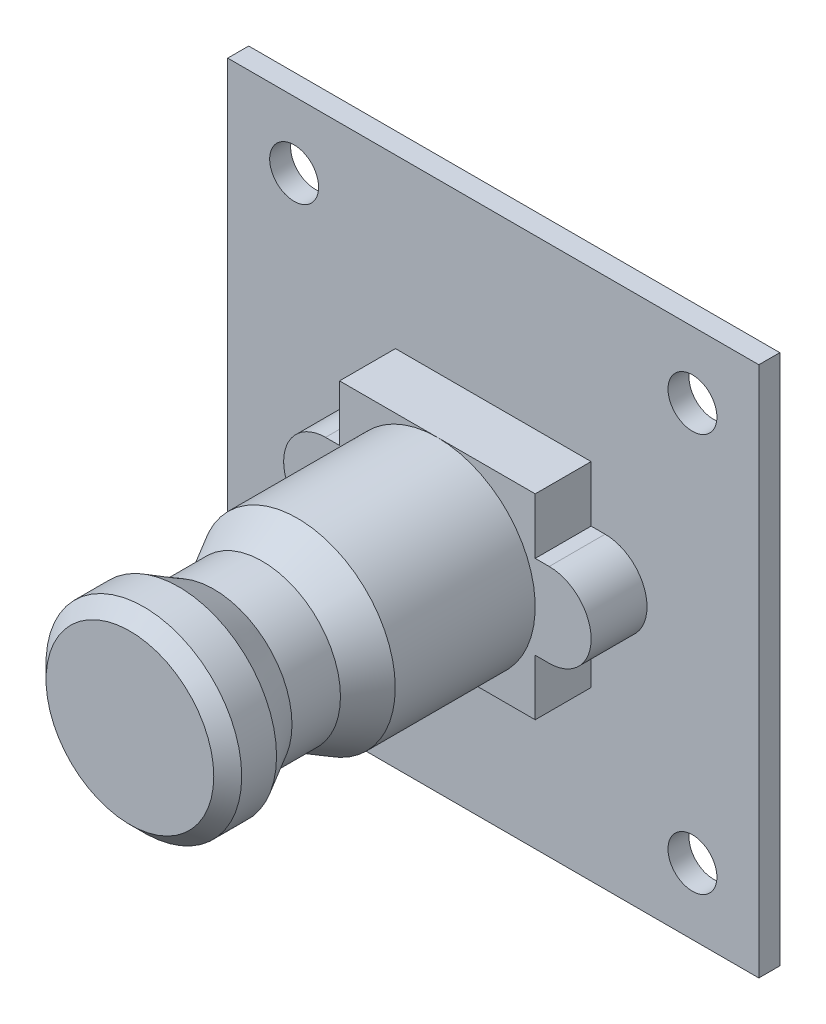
SolidWorks part; units mm, degrees
ref_plane "前视" through (0, 0, 0) normal (0, 0, 1) x (1, 0, 0)
ref_plane "上视" through (0, 0, 0) normal (0, 1, 0) x (1, 0, 0)
ref_plane "右视" through (0, 0, 0) normal (1, 0, 0) x (0, 0, -1)
sketch "草图1" plane through (0, 0, 0) normal (0, 0, 1) x (1, 0, 0)
  line L1 (-19, 19) -> (19, 19)
  line L2 (-19, 19) -> (-19, -19)
  line L3 (-19, -19) -> (19, -19)
  line L4 (19, 19) -> (19, -19)
  line L5 (-19, 19) -> (19, -19) construction
  line L6 (-19, -19) -> (19, 19) construction
  point P0 (0, 0)
  dimension "D1" = 38
  dimension "D2" = 38
extrude "凸台-拉伸1" add sketch "草图1" along normal blind 1.5
hole_wizard "Ø3.5 (3.5) 直径孔1" positions "草图3" profile "草图2" hole size "Ø3.5" standard "GB"
sketch "草图3" plane through (0, 0, 1.5) normal (0, 0, 1) x (1, 0, 0)
  point P0 (-14.25, 14.25)
  point P2 (14.25, 14.25)
  point P4 (14.25, -14.25)
  point P6 (-14.25, -14.25)
  point P10 (-14.25, 14.25)
  point P11 (-14.25, -14.25)
  point P12 (14.25, -14.25)
  point P13 (14.25, 14.25)
  dimension "D1" = 28.5
  dimension "D2" = 28.5
  dimension "D3" = 14.25
  dimension "D4" = 14.25
  dimension "D5" = 28.5
  dimension "D6" = 14.25
  dimension "D7" = 14.25
  dimension "D8" = 14.25
sketch "草图2" plane through (-14.25, 14.25, 1.5) normal (1, 0, 0) x (0, -1, 0)
  line L0 (0, 0) -> (0, 6.0515)
  line L1 (0, 6.0515) -> (1.75, 5)
  line L2 (1.75, 5) -> (1.75, 0)
  line L5 (1.75, 0) -> (0, 0)
  line L10 (0, 6.0515) -> (-1.75, 5) construction
  line L11 (0, -6.35) -> (0, 107.95) construction
  dimension "孔直径" = 3.5
  dimension "孔深度" = 5
  dimension "导头角度" = 118
sketch "草图4" plane through (0, 0, 1.5) normal (0, 0, 1) x (1, 0, 0)
  line L1 (-7, 7) -> (7, 7)
  line L2 (-7, 7) -> (-7, -7)
  line L3 (-7, -7) -> (7, -7)
  line L4 (7, 7) -> (7, -7)
  line L5 (-7, 7) -> (7, -7) construction
  line L6 (-7, -7) -> (7, 7) construction
  point P0 (0, 0)
  dimension "D1" = 14
  dimension "D2" = 14
extrude "凸台-拉伸2" add sketch "草图4" along normal blind 4
sketch "草图5" plane through (0, 0, 5.5) normal (0, 0, 1) x (1, 0, 0)
  line L0 (-8, 0) -> (8, 0) construction
  line L1 (-8, 3) -> (8, 3)
  line L2 (-8, -3) -> (8, -3)
  arc A0 (-8, 3) -> (-8, -3) centre (-8, 0) ccw
  arc A1 (8, -3) -> (8, 3) centre (8, 0) ccw
  point P3 (0, 0)
  dimension "D2" = 3
  dimension "D1" = 16
  dimension "D3" = 8
extrude "凸台-拉伸3" add sketch "草图5" against normal blind 4
sketch "草图6" plane through (0, 0, 5.5) normal (0, 0, 1) x (1, 0, 0)
  circle A0 centre (0, 0) radius 7
extrude "凸台-拉伸4" add sketch "草图6" along normal blind 22
chamfer "倒角1" distance 1 angle 45 1 edges at (7, 0, 27.5)
sketch "草图8" plane through (0, 0, 0) normal (0, 1, 0) x (1, 0, 0)
  line L0 (7, -24.0064) -> (5.5917, -21.4946)
  line L1 (7, -26.5) -> (7, -5.5) construction
  line L2 (5.5917, -21.4946) -> (5.5917, -18.026)
  line L3 (5.5917, -18.026) -> (7, -15.5142)
  line L4 (7, -15.5142) -> (7, -24.0064)
ref_axis "基准轴1" through (0, 0, 26.5) along (0, 0, -1)
revolve "切除-旋转1" cut sketch "草图8" angle 360 about axis through (0, 0, 26.5) along (0, 0, -1)
sketch "草图9" plane through (0, 0, 0) normal (0, 0, -1) x (-1, 0, 0)
  line L0 (19, -19) -> (-19, -19) construction
  line L1 (-10, -10) -> (0, -10)
  line L2 (-10, -10) -> (-10, -16)
  line L3 (-10, -16) -> (0, -16)
  line L4 (0, -10) -> (0, -16)
  line L5 (-10, -10) -> (0, -16) construction
  line L6 (-10, -16) -> (0, -10) construction
  line L7 (-19, -19) -> (-19, 19) construction
  point P0 (-5, -13)
  dimension "D1" = 10
  dimension "D2" = 6
  dimension "D3" = 3
  dimension "D4" = 9
extrude "凸台-拉伸5" add sketch "草图9" along normal blind 6
